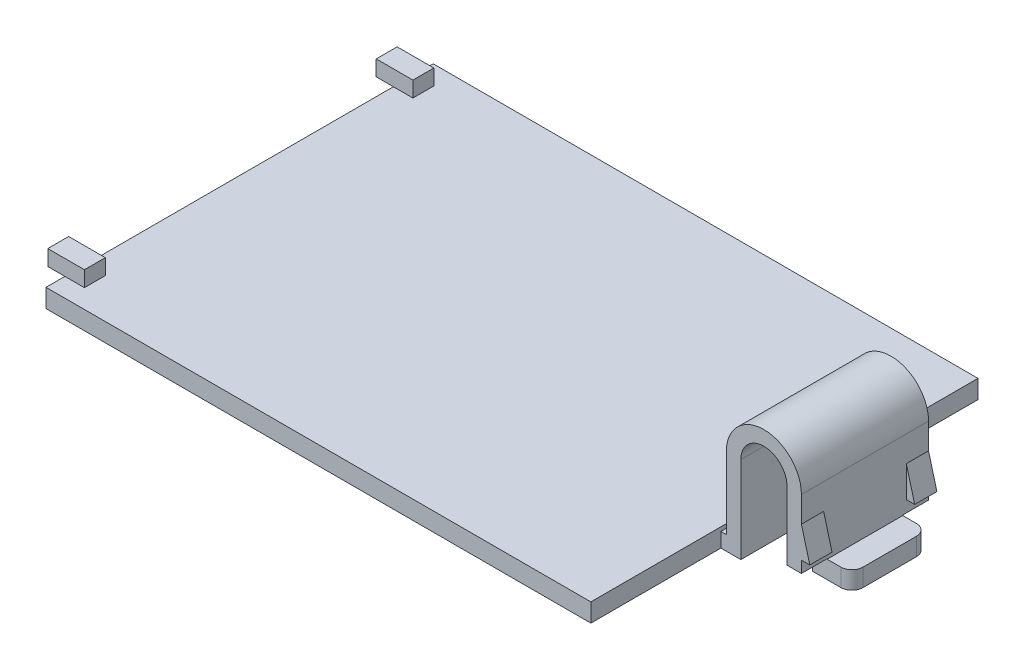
SolidWorks part; units mm, degrees
ref_plane "Plan de face" through (0, 0, 0) normal (0, 0, 1) x (1, 0, 0)
ref_plane "Plan de dessus" through (0, 0, 0) normal (0, 1, 0) x (1, 0, 0)
ref_plane "Plan de droite" through (0, 0, 0) normal (1, 0, 0) x (0, 0, -1)
sketch "Esquisse1" plane through (0, 0, 0) normal (0, 1, 0) x (1, 0, 0)
  line L0 (0, 0) -> (-49.03, 0) construction
  line L1 (0, -17.42) -> (-49.03, -17.42)
  line L2 (0, -17.42) -> (0, 17.42)
  line L3 (0, 17.42) -> (-49.03, 17.42)
  line L4 (-49.03, -17.42) -> (-49.03, 17.42)
  dimension "D1" = 49.03
  dimension "D2" = 34.84
extrude "Extrusion1" add sketch "Esquisse1" along normal blind 1.66
sketch "Esquisse2" plane through (0, 1.66, 0) normal (0, 1, 0) x (-1, 0, 0)
  line L0 (0, 0) -> (49.03, 0) construction
  line L1 (0, 17.42) -> (0, -17.42) construction
  line L2 (49.03, -17.42) -> (49.03, 17.42) construction
  line L3 (49.03, 17.42) -> (0, 17.42) construction
  line L4 (50.5715, 13.84) -> (47.2715, 13.84)
  line L5 (50.5715, 13.84) -> (50.5715, 15.72)
  line L6 (50.5715, 15.72) -> (47.2715, 15.72)
  line L7 (47.2715, 13.84) -> (47.2715, 15.72)
  line L8 (47.2715, -13.84) -> (47.2715, -15.72)
  line L9 (50.5715, -15.72) -> (47.2715, -15.72)
  line L10 (50.5715, -13.84) -> (50.5715, -15.72)
  line L11 (50.5715, -13.84) -> (47.2715, -13.84)
  dimension "D1" = 3.3
  dimension "D2" = 1.88
  dimension "D3" = 1.7
extrude "Extrusion2" add sketch "Esquisse2" along normal blind 1.4
sketch "Esquisse3" plane through (0, 0, 0) normal (0, 0, 1) x (1, 0, 0)
  line L0 (0, 0) -> (1.7986, 0)
  line L1 (1.7986, 0) -> (1.7986, 7.8)
  line L2 (5.9491, 7.8) -> (5.9491, 0)
  arc A0 (1.7986, 7.8) -> (5.9491, 7.8) centre (3.8738, 7.8) cw
  dimension "D1" = 7.8
extrude "Extru.-Mince1" add sketch "Esquisse3" along normal mid plane 11.44 thin
sketch "Esquisse5" plane through (0, 0, 0) normal (0, 1, 0) x (1, 0, 0)
  line L0 (7.2491, -5.72) -> (7.2491, 5.72) construction
  line L1 (7.2491, 3.4) -> (8.4752, 3.4)
  line L2 (7.2491, 3.4) -> (7.2491, -3.4)
  line L3 (7.2491, -3.4) -> (8.4752, -3.4)
  line L4 (9.4752, 2.4) -> (9.4752, -2.4)
  line L5 (0, 0) -> (7.2491, 0) construction
  arc A0 (8.4752, 3.4) -> (9.4752, 2.4) centre (8.4752, 2.4) cw
  arc A1 (8.4752, -3.4) -> (9.4752, -2.4) centre (8.4752, -2.4) ccw
  dimension "D1" = 1
  dimension "D2" = 6.8
extrude "Extrusion3" add sketch "Esquisse5" along normal blind 1.6
sketch "Esquisse6" plane through (7.2491, 0, 0) normal (1, 0, 0) x (0, 0, -1)
  line L0 (5.72, 7.8) -> (5.72, 0) construction
  line L1 (5.72, 1.6439) -> (3.4, 1.6439)
  line L2 (5.72, 1.6439) -> (5.72, 0)
  line L3 (5.72, 0) -> (3.4, 0)
  line L4 (3.4, 1.6439) -> (3.4, 0)
  line L6 (0, 0) -> (0, 5.4322) construction
  line L7 (-3.4, 1.6439) -> (-3.4, 0)
  line L8 (-5.72, 0) -> (-3.4, 0)
  line L9 (-5.72, 1.6439) -> (-5.72, 0)
  line L10 (-5.72, 1.6439) -> (-3.4, 1.6439)
  line L11 (3.4, 1.6) -> (3.4, 0) construction
extrude "Enlèv. mat.-Extru.1" cut sketch "Esquisse6" against normal up to next
sketch "Esquisse7" plane through (0, 0, -5.72) normal (0, 0, -1) x (-1, 0, 0)
  line L0 (-7.2491, 2.6854) -> (-8.0018, 2.6854)
  line L1 (-7.2491, 7.8) -> (-7.2491, 1.6439) construction
  line L2 (-8.0018, 2.6854) -> (-7.2491, 5.4864)
  line L3 (-7.2491, 5.4864) -> (-7.2491, 2.6854)
extrude "Extrusion4" add sketch "Esquisse7" against normal blind 2
mirror "Symétrie1" about plane through (0, 0, 0) normal (0, 0, 1) of "Extrusion4"
